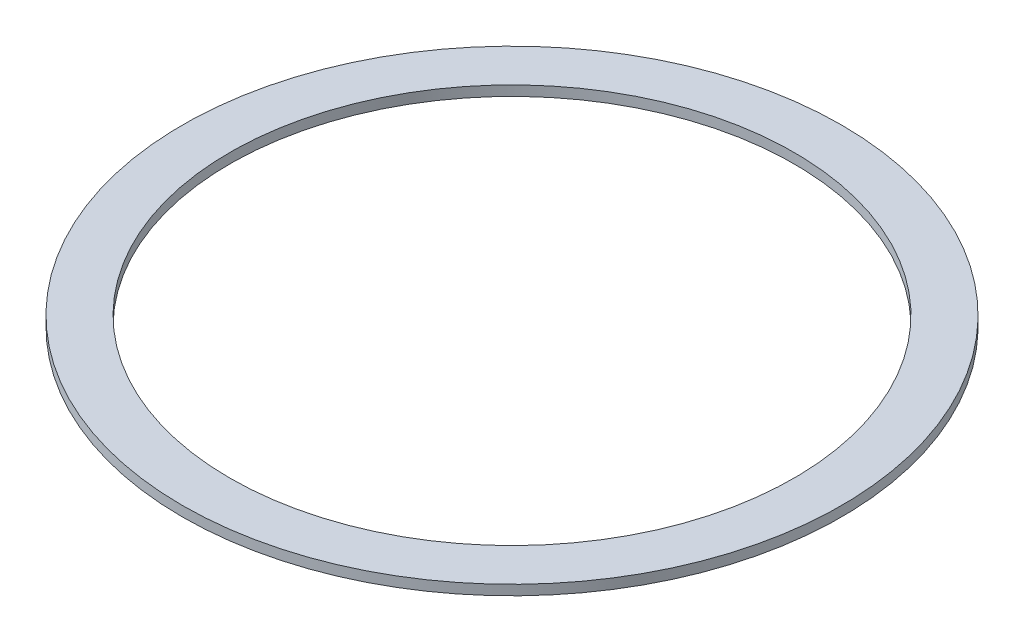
SolidWorks part; units mm, degrees
ref_plane "Face" through (0, 0, 0) normal (0, 0, 1) x (1, 0, 0)
ref_plane "Dessus" through (0, 0, 0) normal (0, 1, 0) x (1, 0, 0)
ref_plane "Droite" through (0, 0, 0) normal (1, 0, 0) x (0, 0, -1)
sketch "Esquisse1" plane through (0, 0, 0) normal (0, 1, 0) x (1, 0, 0)
  circle A0 centre (0, 0) radius 66
  circle A1 centre (0, 0) radius 56.5
  dimension "D1" = 113
  dimension "D2" = 132
extrude "Extrusion1" add sketch "Esquisse1" along normal blind 2
sketch "Esquisse2" [suppressed] plane through (0, 0, 0) normal (0, 0, 1) x (1, 0, 0)
  line L1 (-70.125, 10.0139) -> (69.0556, 10.0139)
  line L2 (-70.125, 10.0139) -> (-70.125, -7.25)
  line L3 (-70.125, -7.25) -> (69.0556, -7.25)
  line L4 (69.0556, 10.0139) -> (69.0556, -7.25)
extrude "Coupe" [suppressed] cut sketch "Esquisse2" along normal through all
